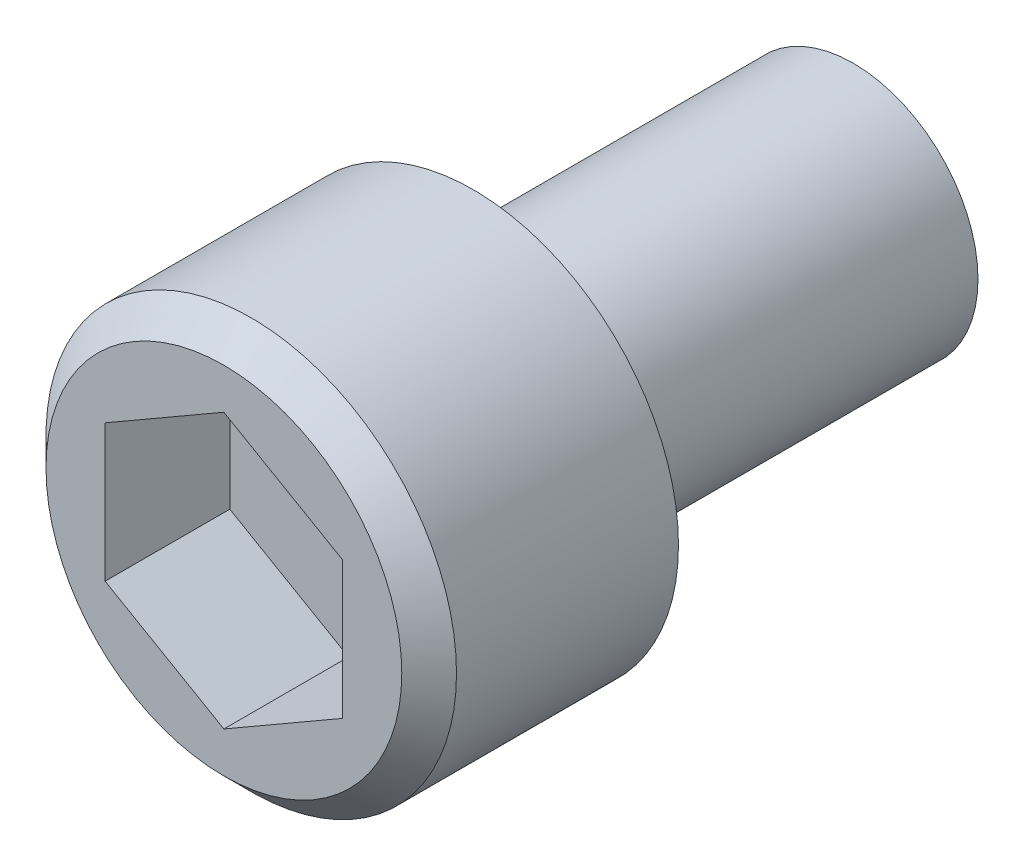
SolidWorks part; units mm, degrees
ref_plane "Plane1" through (0, 0, 0) normal (0, 0, 1) x (1, 0, 0)
ref_plane "Plane2" through (0, 0, 0) normal (0, 1, 0) x (1, 0, 0)
ref_plane "Plane3" through (0, 0, 0) normal (1, 0, 0) x (0, 0, -1)
sketch "Sketch1" plane through (0, 0, 0) normal (0, 0, 1) x (1, 0, 0)
  circle A0 centre (0, 0) radius 2.0828
extrude "Shank" add sketch "Sketch1" along normal blind 6.35
sketch "Sketch2" plane through (0, 0, 6.35) normal (0, 0, 1) x (1, 0, 0)
  circle A0 centre (0, 0) radius 3.429
  dimension "CapDia" = 6.858
extrude "Cap" add sketch "Sketch2" along normal blind 4.1656
fillet "Fillet1" radius 0.3048 1 edges at (2.0828, 0, 6.35)
sketch "Sketch3" plane through (4.8749, 0.9257, 10.5156) normal (0, 0, 1) x (1, 0, 0)
  line L0 (-6.8592, 0.22) -> (-2.8905, 0.22) construction
  line L1 (-6.8592, 0.22) -> (-6.8592, -2.0714) construction
  line L2 (-2.8905, -2.0714) -> (-6.8592, -2.0714) construction
  line L3 (-2.8905, -2.0714) -> (-2.8905, 0.22) construction
  line L4 (-4.8749, 1.3657) -> (-2.8905, 0.22)
  line L5 (-2.8905, 0.22) -> (-2.8905, -2.0714)
  line L6 (-4.8749, -99.8608) -> (-4.8749, 84.0399) construction
  line L7 (-90.4234, -0.9257) -> (85.1888, -0.9257) construction
  line L8 (-6.8592, 0.22) -> (-6.8592, -2.0714)
  line L9 (-4.8749, 1.3657) -> (-6.8592, 0.22)
  line L10 (-4.8749, -3.2171) -> (-2.8905, -2.0714)
  line L11 (-4.8749, -3.2171) -> (-6.8592, -2.0714)
  circle A0 centre (-4.8749, -0.9257) radius 2.2914 construction
  point P14 (-2.8905, -0.9257)
  point P15 (-6.8592, -0.9257)
extrude "HexCut" cut sketch "Sketch3" against normal blind 2.0828
chamfer "Chamfer1" distance 0.4572 angle 45 1 edges at (3.429, 0, 10.5156)
sketch "Sketch4" plane through (0, 0, 0) normal (1, 0, 0) x (0, 0, -1)
  line L0 (27.0106, 0) -> (-16.4041, 0) construction
  line L1 (-6.0452, 0) -> (0, 0) construction
  line L2 (25.3635, 1.7272) -> (-14.9923, 1.7272) construction
  line L3 (0, 1.7272) -> (0, 2.0828)
  line L4 (0, 2.0828) -> (-6.0452, 2.0828) construction
  line L5 (0, 2.0828) -> (-0.0945, 2.0828)
  line L6 (-0.0945, 2.0828) -> (0, 1.7272)
  dimension "MinorDia" = 3.4544
  dimension "ThreadWidth" = 0.0945
revolve "Thread1" [suppressed] cut sketch "Sketch4" angle 360 about L0
sketch "Sketch5" [suppressed] plane through (0, 0, 0) normal (1, 0, 0) x (0, 0, -1)
  line L0 (-0.3895, 38.4691) -> (-0.3895, 8.5846) construction
  line L1 (-0.3895, 2.413) -> (-0.3895, -2.413) construction
  line L2 (-0.3895, 2.413) -> (-0.7789, 2.0193)
  line L3 (0, 2.0193) -> (0, 2.413)
  line L4 (0, 2.413) -> (-0.3895, 2.413)
  line L5 (-0.3895, 2.413) -> (0, 2.0193)
  line L6 (0, 2.0193) -> (0, 2.413) construction
  line L7 (0, 2.413) -> (-0.7789, 2.413) construction
  line L8 (-0.3895, 2.413) -> (0, 2.0193) construction
  line L9 (-0.7789, 2.0193) -> (-0.7789, 2.413)
  line L10 (-0.7789, 2.413) -> (-0.3895, 2.413)
  line L11 (-13.6981, 0) -> (27.2459, 0) construction
  line L12 (-18.6944, 0) -> (-0.3895, 0) construction
  point P9 (-0.3895, 2.413)
  dimension "D1" = 0
revolve "Thread2" [suppressed] cut sketch "Sketch5" angle 360 about L11
pattern_linear "Threads" [suppressed]
equation "\"HexDepth@HexCut\" = .5 * \"ThreadDia@Cap\""
equation "\"Cut@Chamfer1\" =  ( 1 / 15 )  * \"CapDia@Sketch2\""
equation "\"ThreadWidth@Threads\" =\"ThreadWidth@Sketch4\"  * 2"
